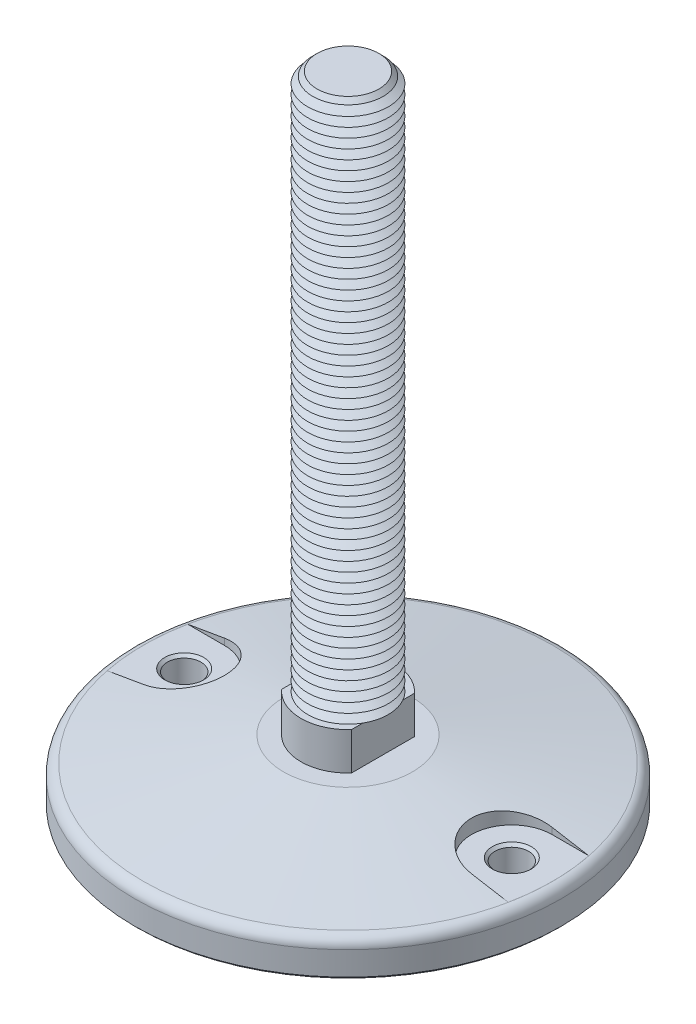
SolidWorks part; units mm, degrees
ref_plane "Front Plane" through (0, 0, 0) normal (0, 0, 1) x (1, 0, 0)
ref_plane "Top Plane" through (0, 0, 0) normal (0, 1, 0) x (1, 0, 0)
ref_plane "Right Plane" through (0, 0, 0) normal (1, 0, 0) x (0, 0, -1)
sketch "Sketch1" plane through (0, 0, 0) normal (1, 0, 0) x (0, 0, -1)
  line L0 (0, 61.3389) -> (0, -58.404) construction
sketch "Sketch2" plane through (0, 0, 0) normal (1, 0, 0) x (0, 0, -1)
  line L0 (0, 0) -> (-24, 0)
  line L1 (-24, 0) -> (-79.5, -9.7861)
  line L2 (-79.5, -9.7861) -> (-79.5, -23)
  line L3 (-79.5, -23) -> (0, -23)
  line L4 (0, 61.3389) -> (0, -58.404) construction
  line L5 (0, -23) -> (0, 0)
  dimension "D1" = 23
  dimension "D2" = 79.5
  dimension "D3" = 24
  dimension "D4" = 10
revolve "Revolve1" add sketch "Sketch2" angle 360 about L0
fillet "Fillet1" radius 4 1 edges at (0, -9.7861, 79.5)
sketch "Sketch3" plane through (0, 0, 0) normal (0, 1, 0) x (1, 0, 0)
  circle A0 centre (0, 0) radius 17.5
  dimension "D1" = 35
extrude "Boss-Extrude1" add sketch "Sketch3" along normal blind 14
sketch "Sketch4" plane through (0, 14, 0) normal (0, 1, 0) x (1, 0, 0)
  line L0 (-13, 11.7154) -> (-13, -11.7154)
  line L2 (13, -11.7154) -> (13, 11.7154)
  arc A0 (-13, 11.7154) -> (-13, -11.7154) centre (0, 0) ccw
  circle A1 centre (0, 0) radius 17.5 construction
  arc A2 (13, -11.7154) -> (13, 11.7154) centre (0, 0) ccw
  dimension "D1" = 26
extrude "Cut-Extrude1" cut sketch "Sketch4" against normal blind 14
sketch "Sketch5" plane through (0, 14, 0) normal (0, 1, 0) x (1, 0, 0)
  circle A0 centre (0, 0) radius 15
  dimension "D1" = 30
extrude "Boss-Extrude2" add sketch "Sketch5" along normal blind 200
chamfer "Chamfer1" distance 3.5 angle 45 1 edges at (0, 214, 15)
sketch "Sketch6" plane through (0, 0, 0) normal (1, 0, 0) x (0, 0, -1)
  line L0 (-15, 14) -> (-11.9689, 15.75)
  line L1 (-11.9689, 15.75) -> (-15, 17.5)
  line L2 (-15, 210.5) -> (-15, 14) construction
  line L3 (-15, 17.5) -> (-15, 14)
  dimension "D1" = 3.5
revolve "Cut-Revolve1" cut sketch "Sketch6" angle 360 about L0
pattern_linear "LPattern1" count 57 spacing 3.5 along (0, 1, 0) of "Cut-Revolve1"
sketch "Sketch8" plane through (0, 0, 0) normal (0, 1, 0) x (1, 0, 0)
  line L0 (-61, 15) -> (-74.7035, 15)
  line L1 (-61, -15) -> (-74.7035, -15)
  arc A1 (-74.7035, 15) -> (-74.7035, -15) centre (0, 0) ccw
  circle A2 centre (0, 0) radius 76.1946 construction
  arc A3 (-61, -15) -> (-61, 15) centre (-61, 0) ccw
  point P3 (-61, 0)
  point P11 (0, 0)
  dimension "D1" = 61
  dimension "D2" = 30
extrude "Cut-Extrude4" cut sketch "Sketch8" against normal blind 9.2
sketch "Sketch10" plane through (0, -9.2, 0) normal (0, 1, 0) x (1, 0, 0)
  circle A0 centre (-61, 0) radius 6.25
  dimension "D1" = 12.5
extrude "Cut-Extrude5" cut sketch "Sketch10" against normal up to surface (13.8 mm away)
chamfer "Chamfer2" distance 1 angle 45 2 edges at (-61, -23, -6.25) (-61, -9.2, 6.25)
mirror "Mirror1" about plane through (0, 0, 0) normal (1, 0, 0) of "Chamfer2", "Cut-Extrude5", "Cut-Extrude4"
chamfer "Chamfer3" distance 1 angle 45 1 edges at (0, -23, 79.5)
